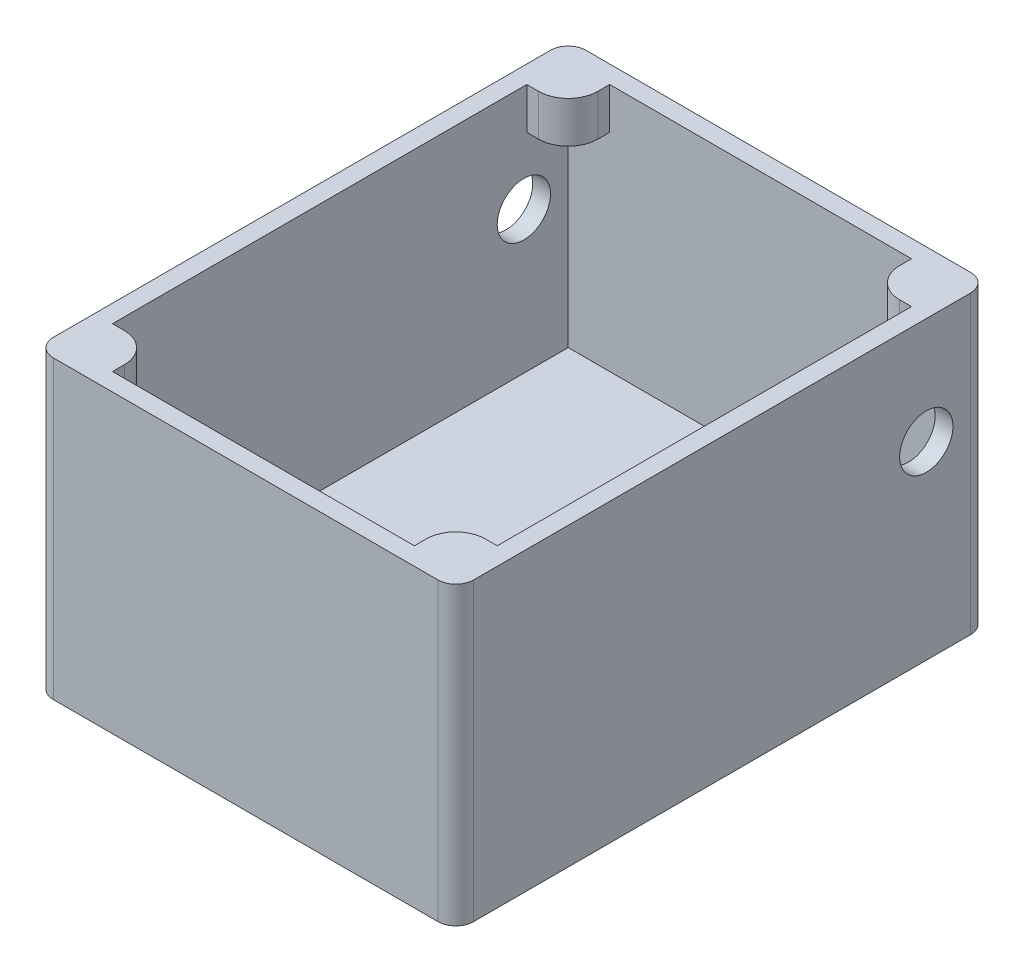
SolidWorks part; units mm, degrees
ref_plane "Front Plane" through (0, 0, 0) normal (0, 0, 1) x (1, 0, 0)
ref_plane "Top Plane" through (0, 0, 0) normal (0, 1, 0) x (1, 0, 0)
ref_plane "Right Plane" through (0, 0, 0) normal (1, 0, 0) x (0, 0, -1)
sketch "Sketch1" plane through (0, 0, 0) normal (0, 1, 0) x (1, 0, 0)
  line L0 (-61.6962, 29.5) -> (-61.6962, -70.5) construction
  line L1 (-61.6962, 26.5) -> (-64.6962, 26.5) construction
  line L2 (-61.6962, -32.5) -> (-10.6962, -32.5) construction
  line L7 (-61.6962, 26.5) -> (-61.6962, -32.5) construction
  line L8 (-10.6962, -32.5) -> (-10.6962, 26.5) construction
  line L9 (-10.6962, 26.5) -> (-61.6962, 26.5) construction
  line L10 (-10.6962, -32.5) -> (-10.6962, -35.5) construction
  line L12 (-61.6962, 26.5) -> (-61.6962, 29.5) construction
  line L13 (-61.6962, 29.5) -> (-27.6962, 29.5) construction
  line L14 (-27.6962, 29.5) -> (6.3038, 29.5) construction
  line L15 (-64.6962, 29.5) -> (6.3038, 29.5)
  line L16 (-64.6962, 29.5) -> (-64.6962, -60.5)
  line L17 (-64.6962, -60.5) -> (6.3038, -60.5)
  line L18 (6.3038, 29.5) -> (6.3038, -60.5)
  point P5 (0, 0)
extrude "Boss-Extrude1" add sketch "Sketch1" along normal blind 50 contours L18 L17 L16 L15
sketch "Sketch2" plane through (0, 50, 0) normal (0, 1, 0) x (1, 0, 0)
  line L4 (-61.6962, 29.5) -> (-61.6962, 26.5) construction
  line L5 (-64.6962, 29.5) -> (6.3038, 29.5) construction
  line L7 (6.3038, -57.5) -> (3.3038, -57.5) construction
  line L8 (6.3038, 29.5) -> (6.3038, -60.5) construction
  line L9 (-61.6962, 26.5) -> (3.3038, 26.5)
  line L10 (-61.6962, 26.5) -> (-61.6962, -57.5)
  line L11 (-61.6962, -57.5) -> (3.3038, -57.5)
  line L12 (3.3038, 26.5) -> (3.3038, -57.5)
extrude "Cut-Extrude1" cut sketch "Sketch2" against normal blind 47
sketch "Sketch3" plane through (0, 3, 0) normal (0, 1, 0) x (1, 0, 0)
  line L0 (-61.6962, 26.5) -> (-61.6962, 23.8379) construction
  line L1 (-61.6962, 26.5) -> (-61.6962, -57.5) construction
  line L2 (-61.6962, 23.8379) -> (-61.6962, -36) construction
  line L3 (-61.6962, 26.5) -> (-61.6962, -57.5) construction
  line L4 (-61.6962, -36) -> (-10.6962, -36) construction
  line L6 (-61.6962, 26.5) -> (-10.6962, 26.5)
  line L7 (-61.6962, 26.5) -> (-61.6962, -36)
  line L8 (-61.6962, -36) -> (-10.6962, -36)
  line L9 (-10.6962, 26.5) -> (-10.6962, -36)
extrude "Boss-Extrude2" add sketch "Sketch3" along normal blind 5
sketch "Sketch4" plane through (-61.6962, 0, 0) normal (1, 0, 0) x (0, 0, -1)
  line L2 (19, 8) -> (19, 32) construction
  line L3 (26.5, 8) -> (-36, 8) construction
  circle A0 centre (19, 32) radius 4.5
extrude "Cut-Extrude2" cut sketch "Sketch4" against normal through all both and the other way through all contours A0
sketch "Sketch5" plane through (0, 50, 0) normal (0, 1, 0) x (1, 0, 0)
  line L1 (-64.6962, -60.5) -> (-54.6962, -60.5)
  line L2 (-64.6962, -60.5) -> (-64.6962, -50.5)
  line L3 (-64.6962, -50.5) -> (-54.6962, -50.5)
  line L4 (-54.6962, -60.5) -> (-54.6962, -50.5)
  line L9 (6.3038, -60.5) -> (-3.6962, -60.5)
  line L10 (6.3038, -60.5) -> (6.3038, -50.5)
  line L11 (6.3038, -50.5) -> (-3.6962, -50.5)
  line L12 (-3.6962, -60.5) -> (-3.6962, -50.5)
  line L13 (6.3038, 29.5) -> (-3.6962, 29.5)
  line L14 (6.3038, 29.5) -> (6.3038, 19.5)
  line L15 (6.3038, 19.5) -> (-3.6962, 19.5)
  line L16 (-3.6962, 29.5) -> (-3.6962, 19.5)
  line L17 (-64.6962, 29.5) -> (-54.6962, 29.5)
  line L18 (-64.6962, 29.5) -> (-64.6962, 19.5)
  line L19 (-64.6962, 19.5) -> (-54.6962, 19.5)
  line L20 (-54.6962, 29.5) -> (-54.6962, 19.5)
extrude "Boss-Extrude3" add sketch "Sketch5" against normal blind 7
fillet "Fillet3" radius 3 1 edges at (-64.6962, 25, -29.5)
fillet "Fillet4" radius 3 1 edges at (6.3038, 25, -29.5)
fillet "Fillet5" radius 3 1 edges at (6.3038, 25, 60.5)
fillet "Fillet6" radius 3 1 edges at (-64.6962, 25, 60.5)
fillet "Fillet7" radius 5 1 edges at (-54.6962, 46.5, -19.5)
fillet "Fillet8" radius 5 1 edges at (-3.6962, 46.5, -19.5)
fillet "Fillet9" radius 5 1 edges at (-54.6962, 46.5, 50.5)
fillet "Fillet10" radius 5 1 edges at (-3.6962, 46.5, 50.5)
